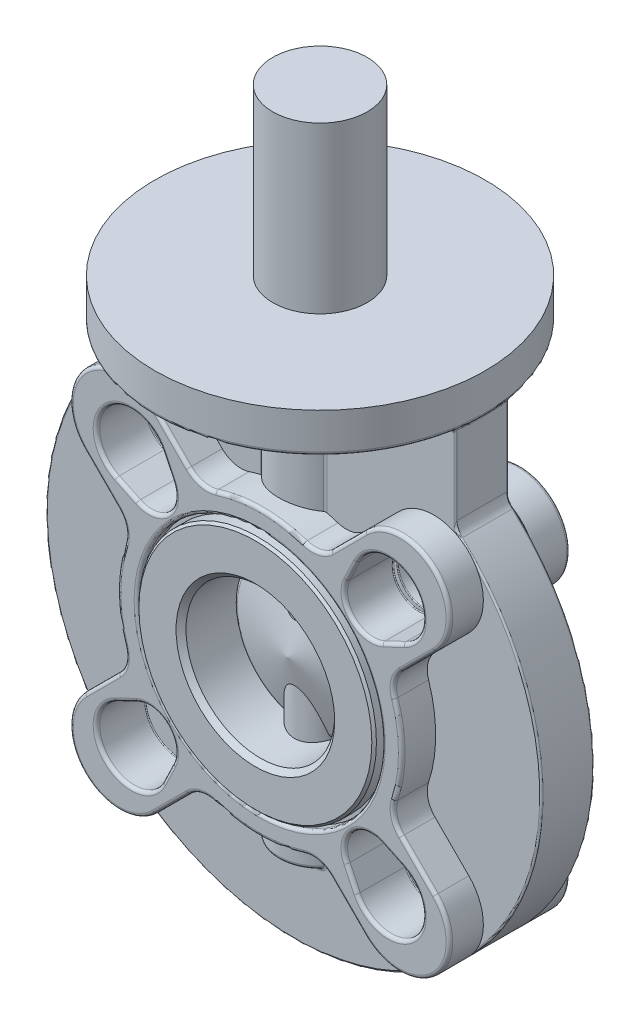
SolidWorks part; units mm, degrees
ref_plane "Front" through (0, 0, 0) normal (0, 0, 1) x (1, 0, 0)
ref_plane "Top" through (0, 0, 0) normal (0, 1, 0) x (1, 0, 0)
ref_plane "Right" through (0, 0, 0) normal (1, 0, 0) x (0, 0, -1)
sketch "Sketch1" plane through (0, 0, 0) normal (0, 0, 1) x (1, 0, 0)
  line L0 (0, 0) -> (0, 80.7469) construction
  line L1 (0, 0) -> (-78.7972, 0) construction
  circle A0 centre (0, 0) radius 75
  dimension "D1" = 150
extrude "Extrude1" add sketch "Sketch1" along normal mid plane 16
sketch "Sketch2" plane through (0, 0, 0) normal (0, 0, 1) x (1, 0, 0)
  circle A0 centre (0, 0) radius 28
  dimension "D1" = 56
extrude "Cut-Extrude1" cut sketch "Sketch2" against normal through all and the other way through all
sketch "Sketch3" plane through (0, 0, 0) normal (0, 0, 1) x (1, 0, 0)
  line L0 (0, 0) -> (0, 113.9869) construction
  line L1 (-49, 56.7803) -> (-49, 83)
  line L2 (49, 56.7803) -> (49, 83)
  line L3 (-49, 83) -> (49, 83)
  circle A0 centre (0, 0) radius 75 construction
  arc A1 (49, 56.7803) -> (-49, 56.7803) centre (0, 0) ccw
  dimension "D1" = 98
  dimension "D2" = 83
extrude "Extrude2" add sketch "Sketch3" along normal mid plane 16
sketch "Sketch4" plane through (0, 83, 0) normal (0, 1, 0) x (1, 0, 0)
  circle A0 centre (0, 0) radius 50
  dimension "D1" = 100
extrude "Extrude3" add sketch "Sketch4" along normal blind 12
fillet "Fillet2" radius 1 1 edges at (0, 83, 50)
fillet "Fillet3" radius 0.5 8 edges at (-49, 70.0096, -8) (49, 70.0096, -8) (-49, 70.0096, 8) (49, 70.0096, 8) (49, 83.0696, -6.0045) (48.7049, 83.0661, 8) (-49, 83.0696, 6.0045) (-48.7049, 83.0661, -8)
sketch "Sketch7" plane through (0, 0, 8) normal (0, 0, 1) x (1, 0, 0)
  line L0 (0, 0) -> (0, 99.8491) construction
  line L1 (0, 0) -> (81.6187, 0) construction
  line L2 (0, 0) -> (60.0356, 60.0356) construction
  line L3 (21.5804, 42.7936) -> (31.8198, 53.033)
  line L4 (42.7936, 21.5804) -> (53.033, 31.8198)
  line L5 (-42.7936, 21.5804) -> (-53.033, 31.8198)
  line L6 (-21.5804, 42.7936) -> (-31.8198, 53.033)
  line L7 (42.7936, -21.5804) -> (53.033, -31.8198)
  line L8 (21.5804, -42.7936) -> (31.8198, -53.033)
  line L9 (-21.5804, -42.7936) -> (-31.8198, -53.033)
  line L10 (-42.7936, -21.5804) -> (-53.033, -31.8198)
  circle A0 centre (0, 0) radius 28 construction
  circle A1 centre (0, 0) radius 28
  circle A2 centre (0, 0) radius 75 construction
  arc A3 (48.5, -57.208) -> (-48.5, -57.208) centre (0, 0) ccw construction
  arc A4 (13.4257, 40.8503) -> (-13.4257, 40.8503) centre (0, 0) ccw
  arc A5 (53.033, 31.8198) -> (31.8198, 53.033) centre (42.4264, 42.4264) ccw
  arc A6 (-53.033, 31.8198) -> (-31.8198, 53.033) centre (-42.4264, 42.4264) cw
  arc A7 (53.033, -31.8198) -> (31.8198, -53.033) centre (42.4264, -42.4264) cw
  arc A8 (-53.033, -31.8198) -> (-31.8198, -53.033) centre (-42.4264, -42.4264) ccw
  arc A9 (40.8503, -13.4257) -> (40.8503, 13.4257) centre (0, 0) ccw
  arc A10 (-13.4257, -40.8503) -> (13.4257, -40.8503) centre (0, 0) ccw
  arc A11 (-40.8503, 13.4257) -> (-40.8503, -13.4257) centre (0, 0) ccw
  arc A12 (-40.8503, 13.4257) -> (-42.7936, 21.5804) centre (-48.4504, 15.9235) ccw
  arc A13 (-42.7936, -21.5804) -> (-40.8503, -13.4257) centre (-48.4504, -15.9235) ccw
  arc A14 (-13.4257, -40.8503) -> (-21.5804, -42.7936) centre (-15.9235, -48.4504) ccw
  arc A15 (21.5804, -42.7936) -> (13.4257, -40.8503) centre (15.9235, -48.4504) ccw
  arc A16 (40.8503, -13.4257) -> (42.7936, -21.5804) centre (48.4504, -15.9235) ccw
  arc A17 (42.7936, 21.5804) -> (40.8503, 13.4257) centre (48.4504, 15.9235) ccw
  arc A18 (13.4257, 40.8503) -> (21.5804, 42.7936) centre (15.9235, 48.4504) ccw
  arc A19 (-21.5804, 42.7936) -> (-13.4257, 40.8503) centre (-15.9235, 48.4504) ccw
  point P32 (-39.1022, 17.889)
  point P35 (-39.1022, -17.889)
  point P38 (-17.889, -39.1022)
  point P41 (17.889, -39.1022)
  point P44 (39.1022, -17.889)
  point P47 (39.1022, 17.889)
  point P50 (17.889, 39.1022)
  point P53 (-17.889, 39.1022)
  dimension "D3" = 43
  dimension "D4" = 8
  dimension "D1" = 45
  dimension "D2" = 30
extrude "Extrude5" add sketch "Sketch7" along normal blind 10.25
mirror "Mirror1" about plane through (0, 0, 0) normal (0, 0, 1) of "Extrude5"
fillet "Fillet5" radius 5
sketch "Sketch9" plane through (0, 83, 0) normal (0, -1, 0) x (1, 0, 0)
  circle A0 centre (0, 0) radius 12.5
  dimension "D1" = 25
extrude "Extrude7" add sketch "Sketch9" along normal up to next
sketch "Sketch11" plane through (0, 0, 18.25) normal (0, 0, 1) x (1, 0, 0)
  circle A0 centre (0, 0) radius 37
  dimension "D1" = 74
extrude "Cut-Extrude3" cut sketch "Sketch11" against normal blind 3
mirror "Mirror2" about plane through (0, 0, 0) normal (0, 0, 1) of "Cut-Extrude3"
sketch "Sketch12" plane through (0, 0, 18.25) normal (0, 0, 1) x (1, 0, 0)
  line L0 (0, 0) -> (60.6927, 60.6927) construction
  line L1 (0, 0) -> (82.1674, 0) construction
  line L2 (0, 0) -> (0, 99.0261) construction
  circle A0 centre (0, 0) radius 49.25 construction
  circle A1 centre (34.825, 34.825) radius 7.874
  circle A2 centre (-34.825, 34.825) radius 7.874
  circle A3 centre (34.825, -34.825) radius 7.874
  circle A4 centre (-34.825, -34.825) radius 7.874
  dimension "D2" = 98.5
  dimension "D3" = 15.748
  dimension "D1" = 45
extrude "Cut-Extrude4" cut sketch "Sketch12" against normal through all and the other way through all
sketch "Sketch13" plane through (0, 0, 18.25) normal (0, 0, 1) x (1, 0, 0)
  line L0 (0, 0) -> (58.7723, 58.7723) construction
  line L1 (0, 0) -> (82.9904, 0) construction
  line L2 (29.416, 43.416) -> (26.3686, 37.0353)
  line L3 (43.416, 29.416) -> (37.0353, 26.3686)
  line L4 (43.416, -29.416) -> (37.0353, -26.3686)
  line L5 (29.416, -43.416) -> (26.3686, -37.0353)
  line L6 (0, 0) -> (0, 101.7695) construction
  line L7 (-29.416, -43.416) -> (-26.3686, -37.0353)
  line L8 (-43.416, -29.416) -> (-37.0353, -26.3686)
  line L9 (-43.416, 29.416) -> (-37.0353, 26.3686)
  line L10 (-29.416, 43.416) -> (-26.3686, 37.0353)
  circle A0 centre (0, 0) radius 47.5 construction
  circle A1 centre (0, 0) radius 55 construction
  arc A2 (43.416, -29.416) -> (29.416, -43.416) centre (38.8909, -38.8909) cw
  arc A3 (26.3686, -37.0353) -> (37.0353, -26.3686) centre (33.5876, -33.5876) cw
  arc A4 (26.3686, 37.0353) -> (37.0353, 26.3686) centre (33.5876, 33.5876) ccw
  arc A5 (-26.3686, -37.0353) -> (-37.0353, -26.3686) centre (-33.5876, -33.5876) ccw
  arc A6 (43.416, 29.416) -> (29.416, 43.416) centre (38.8909, 38.8909) ccw
  arc A7 (-43.416, -29.416) -> (-29.416, -43.416) centre (-38.8909, -38.8909) ccw
  arc A8 (-43.416, 29.416) -> (-29.416, 43.416) centre (-38.8909, 38.8909) cw
  arc A9 (-26.3686, 37.0353) -> (-37.0353, 26.3686) centre (-33.5876, 33.5876) cw
  dimension "D2" = 95
  dimension "D3" = 110
  dimension "D4" = 10.5
  dimension "D5" = 8
  dimension "D1" = 45
extrude "Cut-Extrude5" cut sketch "Sketch13" against normal blind 14.75
mirror "Mirror3" about plane through (0, 0, 0) normal (0, 0, 1) of "Cut-Extrude5"
fillet "Fillet8" radius 0.25 20 edges at (46.3155, -46.3155, -3.5) (40.2256, -27.8923, -3.5) (27.9307, -27.9307, -3.5) (27.8923, -40.2256, -3.5) (42.699, -34.825, -3.5) (27.9307, 27.9307, -3.5) (40.2256, 27.8923, -3.5) (46.3155, 46.3155, -3.5) (27.8923, 40.2256, -3.5) (26.951, 34.825, -3.5) (-27.9307, -27.9307, -3.5) (-40.2256, -27.8923, -3.5) (-46.3155, -46.3155, -3.5) (-27.8923, -40.2256, -3.5) (-42.699, -34.825, -3.5) (-46.3155, 46.3155, -3.5) (-40.2256, 27.8923, -3.5) (-27.9307, 27.9307, -3.5) (-27.8923, 40.2256, -3.5) (-26.951, 34.825, -3.5)
ref_plane "Plane1" through (0, -52, 0) normal (0, 1, 0) x (-1, 0, 0)
sketch "Sketch14" plane through (0, -52, 0) normal (0, 1, 0) x (-1, 0, 0)
  circle A0 centre (0, 0) radius 12.5
extrude "Extrude8" add sketch "Sketch14" along normal up to next
fillet "Fillet6" radius 1 10 edges at (1.6778, -42.9673, 12.3869) (-9.6047, -46.9568, 8) (0, -52, 12.5) (9.6047, -46.9568, 8) (0, -52, 8) (-9.6047, -46.9568, -8) (0, -52, -8) (9.6047, -46.9568, -8) (1.6778, -42.9673, -12.3869) (0, -52, -12.5)
sketch "Sketch32" plane through (0, 0, 0) normal (0, 0, 1) x (1, 0, 0)
  circle A1 centre (0, 0) radius 22.5
  circle A4 centre (0, 0) radius 35.941
  dimension "D1" = 45
  dimension "D2" = 71.882
extrude "Extrude20" add sketch "Sketch32" along normal mid plane 39.116
chamfer "Chamfer1" distance 0.7 angle 45 2 edges at (35.941, 0, -19.558) (35.941, 0, 19.558)
chamfer "Chamfer2" distance 1.5 angle 45
sketch "Sketch33" plane through (0, 0, 0) normal (0, 1, 0) x (1, 0, 0)
  line L0 (0, 0) -> (45.6702, 0) construction
  line L1 (0, 0) -> (0, -26.6009) construction
  line L2 (0, 0) -> (0, 27.0667) construction
  line L3 (22.479, -2.0507) -> (22.479, 2.0507)
  line L4 (0, -10) -> (0, 10)
  line L5 (0, -7.5) -> (0, 7.5) construction
  line L6 (0, -17.25) -> (0, -8) construction
  arc A0 (0, -10) -> (21.0973, -3.9527) centre (-75.4779, 293.1455) ccw
  arc A2 (21.0973, -3.9527) -> (22.479, -2.0507) centre (20.479, -2.0507) ccw
  arc A3 (21.0973, 3.9527) -> (22.479, 2.0507) centre (20.479, 2.0507) cw
  arc A4 (0, 10) -> (21.0973, 3.9527) centre (-75.4779, -293.1455) cw
  point P8 (22.479, -3.5)
  point P11 (22.479, -3.5)
  point P17 (22.479, 0)
  point P22 (22.479, 3.5)
  dimension "D3" = 20
  dimension "D5" = 2
  dimension "D1" = 22.479
  dimension "D2" = 3.5
revolve "Revolve1" add sketch "Sketch33" angle 360 about L1
sketch "Sketch34" plane through (0, 0, 0) normal (0, 1, 0) x (1, 0, 0)
  circle A0 centre (0, 0) radius 7.7191
extrude "Extrude21" add sketch "Sketch34" along normal mid plane 50
sketch "Sketch35" plane through (0, 95, 0) normal (0, 1, 0) x (1, 0, 0)
  circle A0 centre (0, 0) radius 14.2929
extrude "Extrude22" add sketch "Sketch35" along normal blind 50
